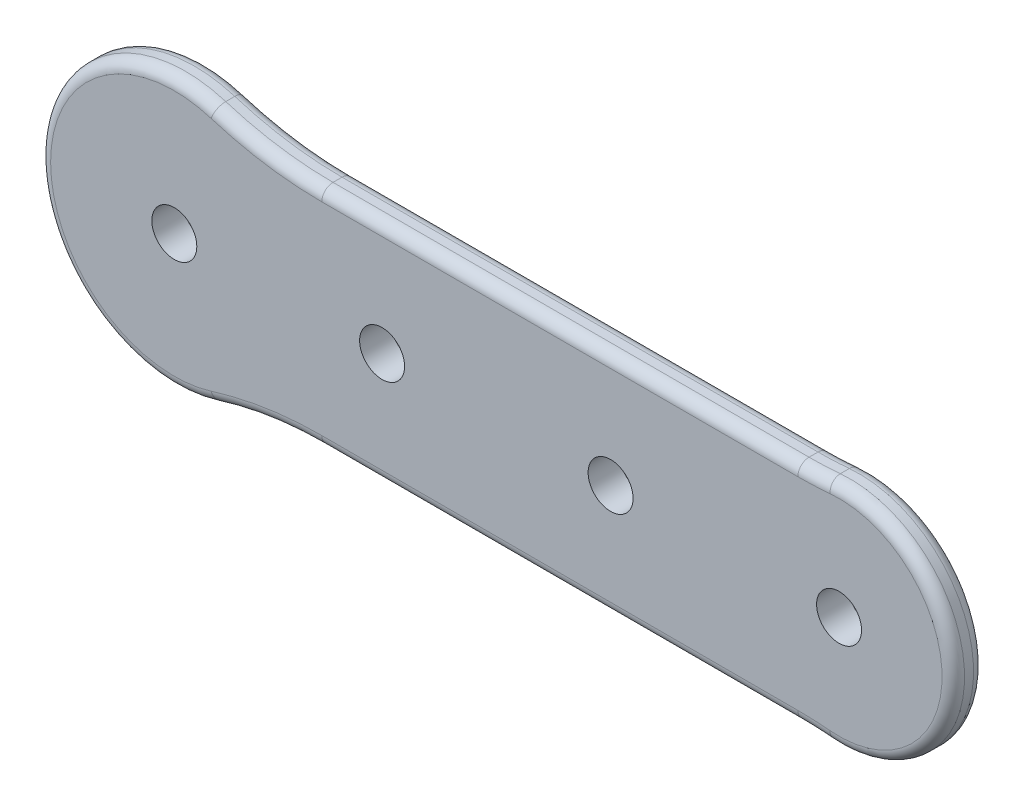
SolidWorks part; units mm, degrees
ref_plane "Front Plane" through (0, 0, 0) normal (0, 0, 1) x (1, 0, 0)
ref_plane "Top Plane" through (0, 0, 0) normal (0, 1, 0) x (1, 0, 0)
ref_plane "Right Plane" through (0, 0, 0) normal (1, 0, 0) x (0, 0, -1)
sketch "Sketch1" plane through (0, 0, 0) normal (0, 0, 1) x (1, 0, 0)
  line L1 (-73.9, 25) -> (73.9, 25)
  line L2 (-73.9, 25) -> (-73.9, -25)
  line L3 (-73.9, -25) -> (73.9, -25)
  line L4 (73.9, 25) -> (73.9, -25)
  line L5 (-73.9, 25) -> (73.9, -25) construction
  line L6 (-73.9, -25) -> (73.9, 25) construction
  circle A0 centre (-73.9, 0) radius 30
  circle A1 centre (73.9, 0) radius 25.4
  circle A2 centre (73.9, 0) radius 5
  circle A3 centre (-73.9, 0) radius 5
  circle A4 centre (23.1, 0) radius 5
  circle A5 centre (-27.7, 0) radius 5
  point P0 (0, 0)
  point P10 (99.3, 0)
  point P11 (-103.9, 0)
  dimension "D1" = 50.8
  dimension "D2" = 60
  dimension "D5" = 50.8
  dimension "D6" = 50.8
  dimension "D7" = 10
  dimension "D8" = 10
  dimension "D9" = 10
  dimension "D10" = 10
  dimension "D3" = 50
  dimension "D4" = 203.2
extrude "Boss-Extrude1" add sketch "Sketch1" along normal blind 7 contours A1 L1 A0 L3 A5 A4 | A2 L4 L3 A1 L1 | A2 L4 L1 A1 L3 | A3 L2 L3 A0 L1 | A3 L2 L1 A0 L3
fillet "Fillet1" radius 80 4 edges at (69.41, -25, 3.5) (69.41, 25, 3.5) (-57.3169, -25, 3.5) (-57.3169, 25, 3.5)
fillet "Fillet2" radius 2.5 16 edges at (-53.1733, 25.9143, 7) (-53.1733, 25.9143, 0) (-103.9, 0, 0) (-103.9, 0, 7) (-53.1733, -25.9143, 7) (-53.1733, -25.9143, 0) (11.8067, -25, 0) (11.8067, -25, 7) (68.211, -25.0759, 7) (68.211, -25.0759, 0) (99.3, 0, 7) (99.3, 0, 0) (68.211, 25.0759, 7) (68.211, 25.0759, 0) (11.8067, 25, 7) (11.8067, 25, 0)
